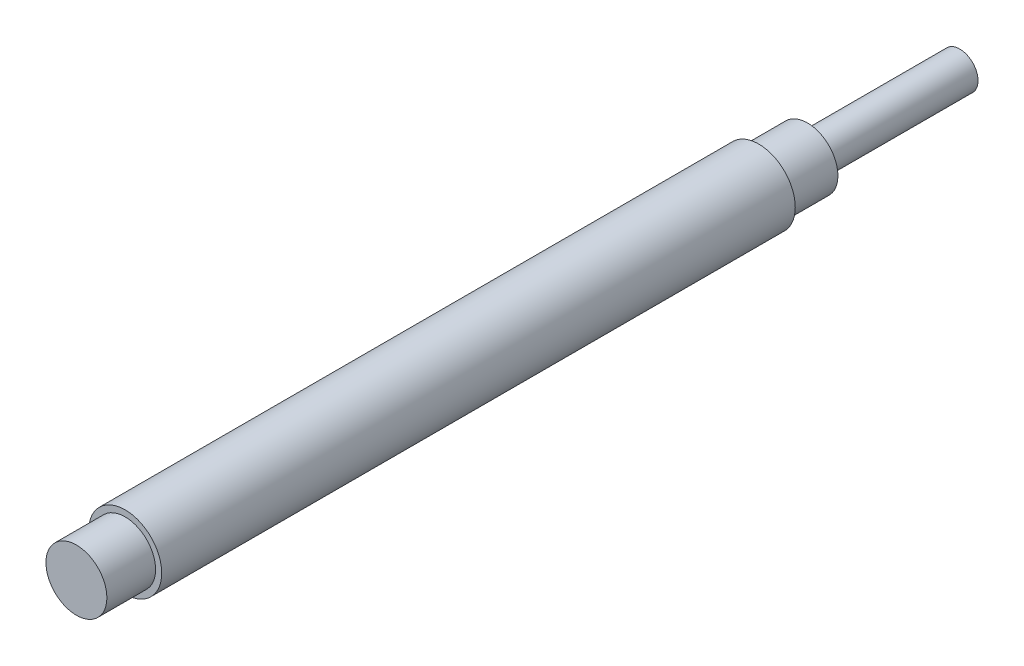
SolidWorks part; units mm, degrees
ref_plane "Plano frontal" through (0, 0, 0) normal (0, 0, 1) x (1, 0, 0)
ref_plane "Plano superior" through (0, 0, 0) normal (0, 1, 0) x (1, 0, 0)
ref_plane "Plano direito" through (0, 0, 0) normal (1, 0, 0) x (0, 0, -1)
sketch "Esboço1" plane through (0, 0, 0) normal (0, 0, 1) x (1, 0, 0)
  circle A0 centre (0, 0) radius 3
  dimension "D1" = 6
extrude "Ressalto-extrusão1" add sketch "Esboço1" along normal blind 72.5
sketch "Esboço2" plane through (0, 0, 72.5) normal (0, 0, 1) x (1, 0, 0)
  circle A0 centre (0, 0) radius 3
  circle A1 centre (0, 0) radius 2.5
  dimension "D1" = 6
  dimension "D2" = 5
extrude "Corte-extrusão1" cut sketch "Esboço2" against normal blind 4
sketch "Esboço3" plane through (0, 0, 0) normal (0, 0, -1) x (-1, 0, 0)
  circle A0 centre (0, 0) radius 3
  circle A1 centre (0, 0) radius 2.5
  dimension "D1" = 6
  dimension "D2" = 5
extrude "Corte-extrusão2" cut sketch "Esboço3" against normal offset from surface (16.5 mm away) 52
sketch "Esboço4" plane through (0, 0, 0) normal (0, 0, -1) x (-1, 0, 0)
  circle A0 centre (0, 0) radius 2.5
  circle A1 centre (0, 0) radius 1.5
  dimension "D1" = 5
  dimension "D2" = 3
extrude "Corte-extrusão3" cut sketch "Esboço4" against normal offset from surface (12.5 mm away) 4
